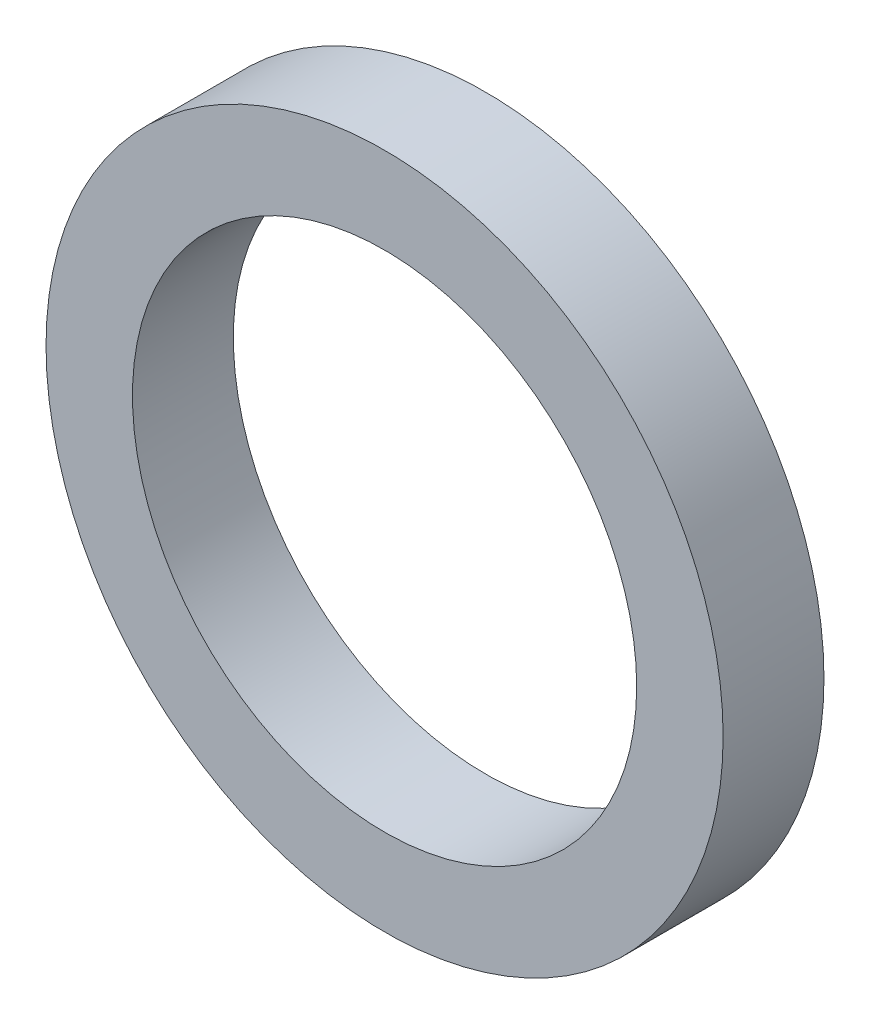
SolidWorks part; units mm, degrees
ref_plane "前视基准面" through (0, 0, 0) normal (0, 0, 1) x (1, 0, 0)
ref_plane "上视基准面" through (0, 0, 0) normal (0, 1, 0) x (1, 0, 0)
ref_plane "右视基准面" through (0, 0, 0) normal (1, 0, 0) x (0, 0, -1)
sketch "草图1" plane through (0, 0, 0) normal (0, 0, 1) x (1, 0, 0)
  circle A0 centre (0, 0) radius 17.5
  circle A1 centre (0, 0) radius 23.5
  dimension "D1" = 35
  dimension "D2" = 47
extrude "凸台-拉伸1" add sketch "草图1" along normal blind 7
